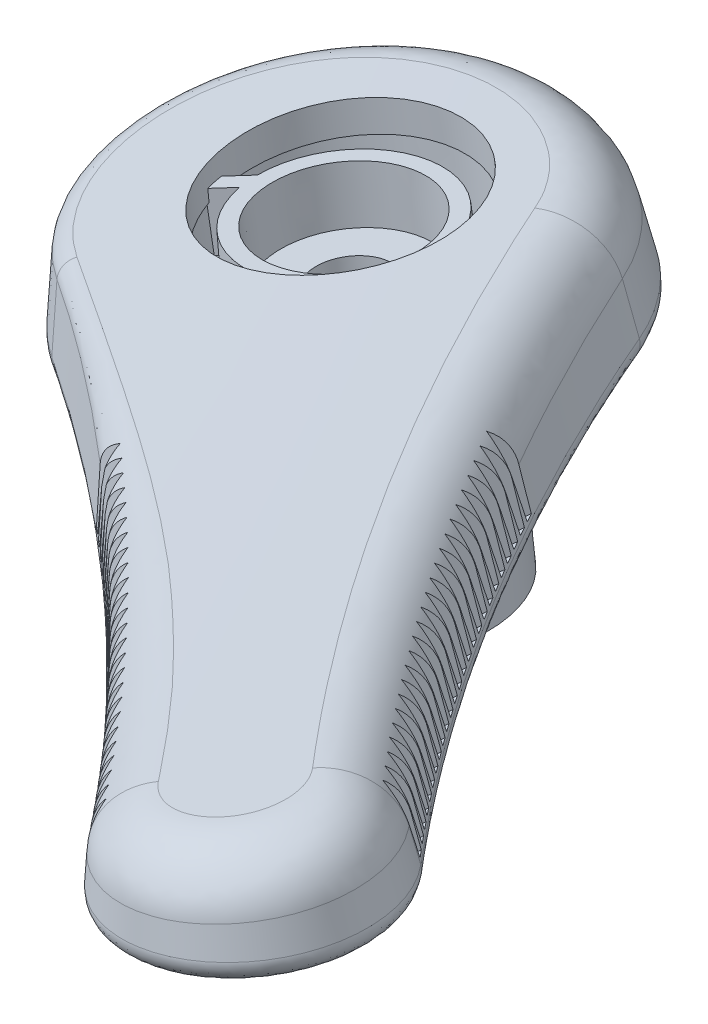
SolidWorks part; units mm, degrees
ref_plane "Front" through (0, 0, 0) normal (0, 0, 1) x (1, 0, 0)
ref_plane "Top" through (0, 0, 0) normal (0, 1, 0) x (1, 0, 0)
ref_plane "Right" through (0, 0, 0) normal (1, 0, 0) x (0, 0, -1)
imported_body "Surface-Imported2"
surface "Surface-Extend2" parameters "D1"=5, "D2"=5
surface "Surface-Fill1"
surface "Surface-Trim1"
surface "Surface-Trim2"
sketch "Sketch1" plane through (32.5799, -300.9277, -8.8774) normal (0.1076, -0.9938, -0.0293) x (0.9942, 0.1075, 0.0032)
  line L0 (1661.4419, 602.8642) -> (1664.0038, 605.936) construction
  line L1 (1672.0299, 615.5835) -> (1674.5919, 618.6553) construction
  line L2 (1680.4404, 625.6869) -> (1683.0024, 628.7587) construction
  line L3 (1688.104, 634.8931) -> (1690.666, 637.9649) construction
  circle A0 centre (1662.7228, 604.4001) radius 2
  circle A1 centre (1673.3109, 617.1194) radius 2
  circle A2 centre (1681.7214, 627.2228) radius 2
  circle A3 centre (1689.385, 636.429) radius 2
  point P11 (1683.0024, 628.7587)
  point P12 (1680.4404, 625.6869)
  point P13 (1680.4404, 625.6869)
  point P14 (1683.0024, 628.7587)
surface "Surface-Extrude1" sketch "Sketch1"
surface "Surface-Plane1"
surface "Surface-Knit1"
